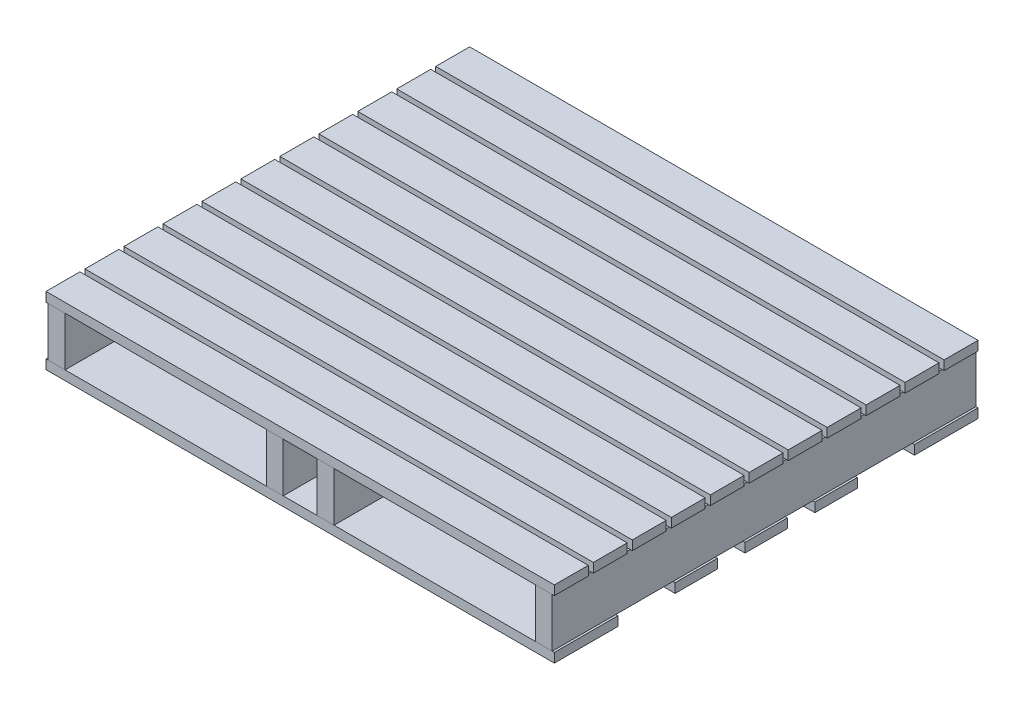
SolidWorks part; units mm, degrees
ref_plane "Front Plane" through (0, 0, 0) normal (0, 0, 1) x (1, 0, 0)
ref_plane "Top Plane" through (0, 0, 0) normal (0, 1, 0) x (1, 0, 0)
ref_plane "Right Plane" through (0, 0, 0) normal (1, 0, 0) x (0, 0, -1)
sketch "Sketch1" plane through (0, 0, 0) normal (0, 1, 0) x (1, 0, 0)
  line L1 (600, -500) -> (-600, -500)
  line L2 (600, -500) -> (600, 500)
  line L3 (600, 500) -> (-600, 500)
  line L4 (-600, -500) -> (-600, 500)
  line L5 (600, -500) -> (-600, 500) construction
  line L6 (600, 500) -> (-600, -500) construction
  point P0 (0, 0)
  dimension "宽度" = 1200
  dimension "长度" = 1000
extrude "Boss-Extrude1" add sketch "Sketch1" along normal blind 22
sketch "Sketch2" plane through (0, 22, 0) normal (0, 1, 0) x (1, 0, 0)
  line L0 (-600, 500) -> (-600, -500) construction
  line L1 (-600, 350) -> (600, 350)
  line L2 (-600, 350) -> (-600, 215)
  line L3 (-600, 215) -> (600, 215)
  line L4 (600, 350) -> (600, 215)
  line L5 (600, -500) -> (600, 500) construction
  line L6 (600, 500) -> (-600, 500) construction
  line L7 (600, 115) -> (-600, 115)
  line L8 (600, 115) -> (600, 50)
  line L9 (600, 50) -> (-600, 50)
  line L10 (-600, 115) -> (-600, 50)
  line L11 (-600, -50) -> (600, -50)
  line L12 (-600, -50) -> (-600, -115)
  line L13 (-600, -115) -> (600, -115)
  line L14 (600, -50) -> (600, -115)
  line L16 (-600, -215) -> (600, -215)
  line L17 (-600, -215) -> (-600, -350)
  line L18 (-600, -350) -> (600, -350)
  line L19 (600, -215) -> (600, -350)
  dimension "D1" = 150
  dimension "D2" = 100
  dimension "D3" = 100
  dimension "D4" = 65
  dimension "D5" = 100
  dimension "D6" = 150
extrude "Cut-Extrude1" cut sketch "Sketch2" against normal through all
sketch "Sketch3" plane through (0, 22, 0) normal (0, 1, 0) x (1, 0, 0)
  line L0 (-600, 50) -> (-600, -50) construction
  line L1 (-595, 500) -> (-555, 500)
  line L2 (-595, 500) -> (-595, -500)
  line L3 (-595, -500) -> (-555, -500)
  line L4 (-555, 500) -> (-555, -500)
  line L5 (555, 500) -> (595, 500)
  line L6 (555, 500) -> (555, -500)
  line L7 (555, -500) -> (595, -500)
  line L8 (595, 500) -> (595, -500)
  line L9 (-80, 500) -> (-40, 500)
  line L10 (-80, 500) -> (-80, -500)
  line L11 (-80, -500) -> (-40, -500)
  line L12 (-40, 500) -> (-40, -500)
  line L13 (600, 115) -> (600, 215) construction
  line L16 (600, 500) -> (-600, 500) construction
  line L17 (-600, -500) -> (600, -500) construction
  line L18 (40, 0) -> (80, 0) construction
  line L19 (-80, 0) -> (-40, 0) construction
  line L20 (40, -500) -> (80, -500)
  line L21 (40, -500) -> (40, 500)
  line L22 (40, 500) -> (80, 500)
  line L23 (80, -500) -> (80, 500)
  line L24 (-555, 0) -> (-80, 0) construction
  line L25 (-40, 0) -> (40, 0) construction
  line L26 (80, 0) -> (555, 0) construction
  dimension "D1" = 40
  dimension "D2" = 5
  dimension "D3" = 5
  dimension "D4" = 80
extrude "Boss-Extrude2" add sketch "Sketch3" along normal blind 116 separate body
sketch "Sketch4" plane through (0, 138, 0) normal (0, 1, 0) x (1, 0, 0)
  line L0 (-600, -420) -> (-600, -408) construction
  line L1 (-600, -408) -> (600, -408)
  line L2 (-600, -408) -> (-600, -328)
  line L3 (-600, -328) -> (600, -328)
  line L4 (600, -350) -> (-600, -350)
  line L5 (-600, -350) -> (-600, -500)
  line L6 (-600, -500) -> (600, -500)
  line L7 (600, -500) -> (600, -350)
  line L8 (600, -420) -> (-600, -420)
  line L9 (-600, -420) -> (-600, -500)
  line L10 (-600, -500) -> (600, -500)
  line L11 (600, -500) -> (600, -420)
  line L12 (600, 350) -> (600, 500)
  line L13 (-600, 350) -> (600, 350)
  line L14 (-600, 500) -> (-600, 350)
  line L15 (600, 500) -> (-600, 500)
  line L16 (600, 420) -> (600, 500)
  line L17 (-600, 420) -> (600, 420)
  line L18 (-600, 500) -> (-600, 420)
  line L19 (600, 500) -> (-600, 500)
  line L20 (600, -408) -> (600, -328)
  line L21 (-600, -316) -> (600, -316)
  line L22 (-600, -316) -> (-600, -236)
  line L23 (-600, -236) -> (600, -236)
  line L24 (600, -316) -> (600, -236)
  line L25 (-600, -224) -> (600, -224)
  line L26 (-600, -224) -> (-600, -144)
  line L27 (-600, -144) -> (600, -144)
  line L28 (600, -224) -> (600, -144)
  line L29 (-600, -328) -> (-600, -316) construction
  line L30 (-600, -236) -> (-600, -224) construction
  line L31 (-600, -144) -> (-600, -132) construction
  line L32 (-600, -132) -> (600, -132)
  line L33 (-600, -132) -> (-600, -52)
  line L34 (-600, -52) -> (600, -52)
  line L35 (600, -132) -> (600, -52)
  line L37 (-600, -52) -> (-600, -40) construction
  line L38 (-600, -40) -> (600, -40)
  line L39 (-600, -40) -> (-600, 40)
  line L40 (-600, 40) -> (600, 40)
  line L41 (600, -40) -> (600, 40)
  line L42 (-600, 52) -> (600, 52)
  line L43 (-600, 52) -> (-600, 132)
  line L44 (-600, 132) -> (600, 132)
  line L45 (600, 52) -> (600, 132)
  line L47 (-600, 224) -> (-600, 236) construction
  line L48 (-600, 144) -> (600, 144)
  line L49 (-600, 144) -> (-600, 224)
  line L50 (-600, 224) -> (600, 224)
  line L51 (600, 144) -> (600, 224)
  line L52 (-600, 236) -> (600, 236)
  line L53 (-600, 236) -> (-600, 316)
  line L54 (-600, 40) -> (-600, 52) construction
  line L55 (-600, 132) -> (-600, 144) construction
  line L56 (-600, 316) -> (600, 316)
  line L59 (600, 236) -> (600, 316)
  line L60 (-600, 316) -> (-600, 328) construction
  line L61 (-600, 328) -> (600, 328)
  line L62 (-600, 328) -> (-600, 408)
  line L63 (-600, 408) -> (600, 408)
  line L64 (600, 328) -> (600, 408)
  line L65 (-600, 408) -> (-600, 420) construction
  dimension "D3" = 80
  dimension "D1" = 0
  dimension "D2" = 0
extrude "Boss-Extrude3" add sketch "Sketch4" along normal blind 22 separate body
